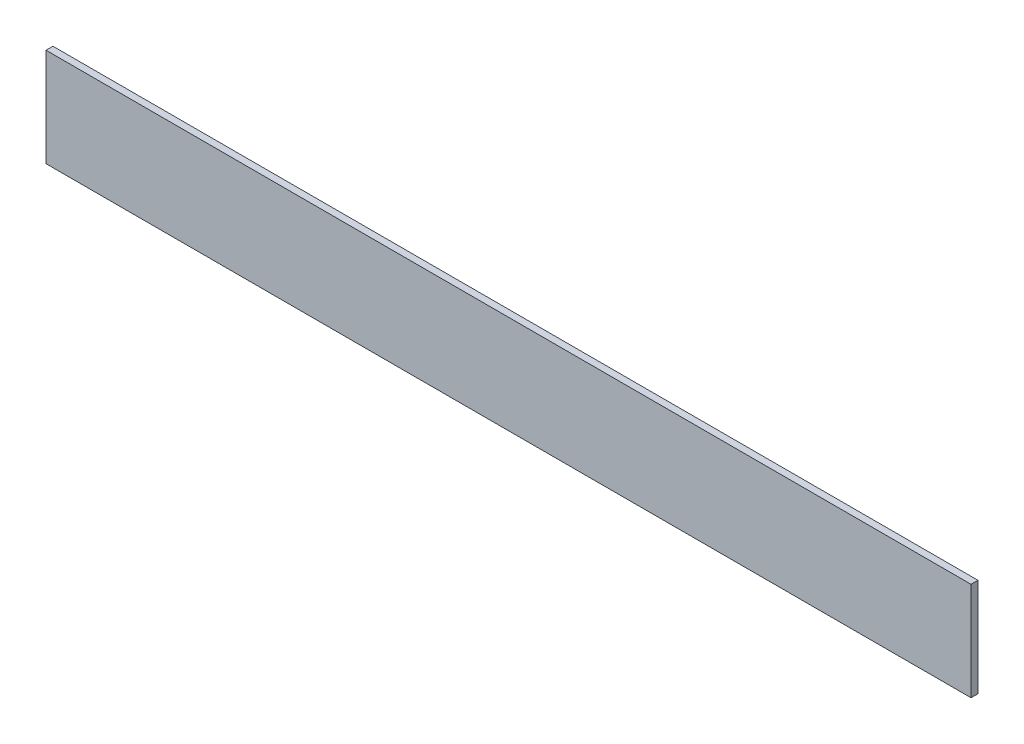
SolidWorks part; units mm, degrees
ref_plane "Front" through (0, 0, 0) normal (0, 0, 1) x (1, 0, 0)
ref_plane "Top" through (0, 0, 0) normal (0, 1, 0) x (1, 0, 0)
ref_plane "Right" through (0, 0, 0) normal (1, 0, 0) x (0, 0, -1)
sketch "Esquisse1" plane through (0, 0, 0) normal (0, 0, 1) x (1, 0, 0)
  line L1 (-400, 34.7495) -> (400, 34.7495)
  line L2 (-400, 34.7495) -> (-400, -50.2505)
  line L3 (-400, -50.2505) -> (400, -50.2505)
  line L4 (400, 34.7495) -> (400, -50.2505)
  dimension "D1" = 800
  dimension "D2" = 400
  dimension "D3" = 85
extrude "Base-Extrusion" add sketch "Esquisse1" along normal blind 6
